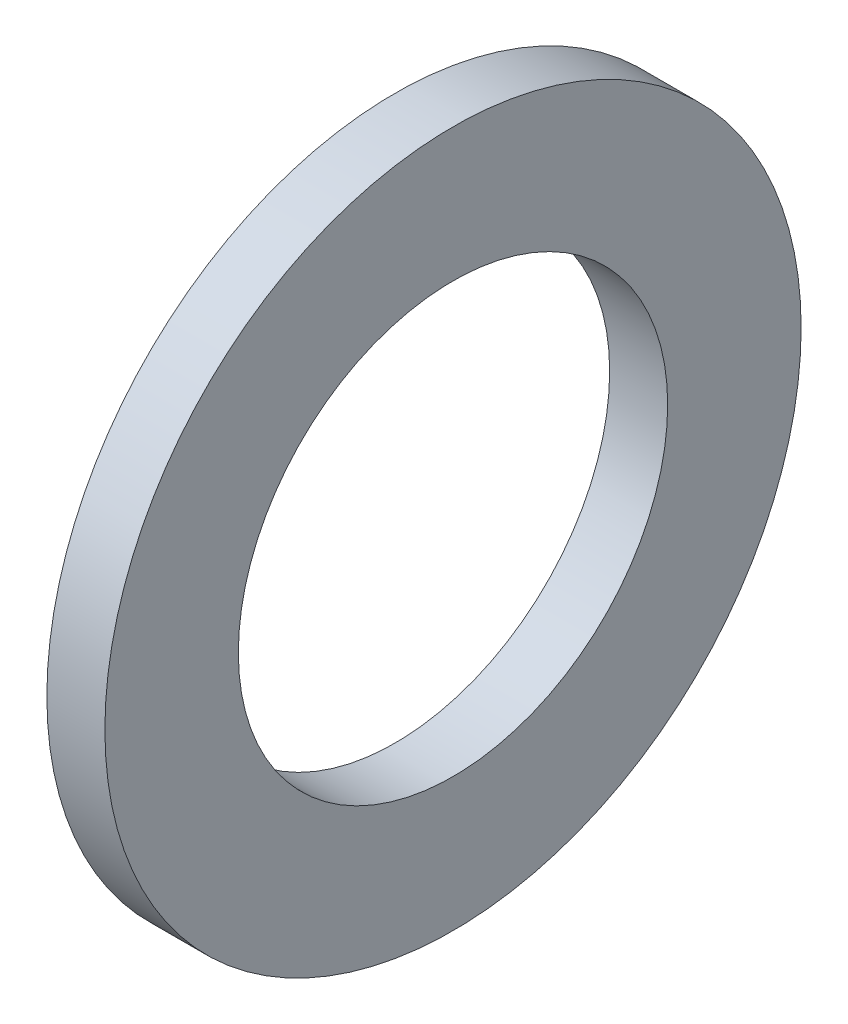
SolidWorks part; units mm, degrees
ref_plane "Plane1" through (0, 0, 0) normal (0, 0, 1) x (1, 0, 0)
ref_plane "Plane2" through (0, 0, 0) normal (0, 1, 0) x (1, 0, 0)
ref_plane "Plane3" through (0, 0, 0) normal (1, 0, 0) x (0, 0, -1)
other "Configuration Table"
sketch "Sketch1" plane through (0, 0, 0) normal (0, 0, 1) x (1, 0, 0)
  line L0 (-34.925, 0) -> (9.525, 0) construction
  line L1 (0, 18.5) -> (0, 30)
  line L2 (0, 30) -> (-5, 30)
  line L3 (-5, 30) -> (-5, 18.5)
  line L4 (-5, 18.5) -> (0, 18.5)
  dimension "Thickness" = 5
  dimension "Inside_dia" = 37
  dimension "Outside_dia" = 60
revolve "Base-Revolve" add sketch "Sketch1" angle 360 about L0
